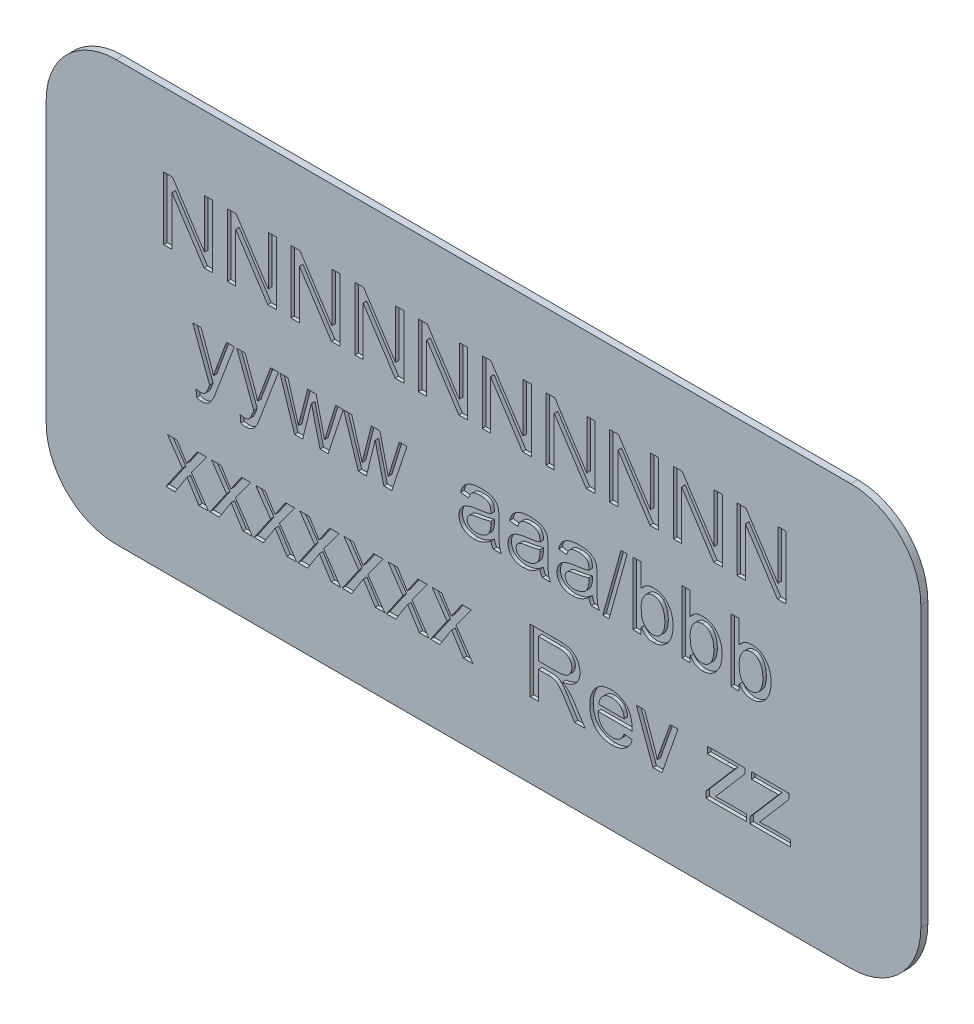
SolidWorks part; units mm, degrees
ref_plane "Plan de face" through (0, 0, 0) normal (0, 0, 1) x (1, 0, 0)
ref_plane "Plan de dessus" through (0, 0, 0) normal (0, 1, 0) x (1, 0, 0)
ref_plane "Plan de droite" through (0, 0, 0) normal (1, 0, 0) x (0, 0, -1)
sketch "Esquisse1" plane through (0, 0, 0) normal (0, 0, 1) x (1, 0, 0)
  line L1 (2, 0) -> (23, 0)
  line L2 (0, 2) -> (0, 10)
  line L3 (2, 12) -> (23, 12)
  line L4 (25, 2) -> (25, 10)
  arc A0 (0, 10) -> (2, 12) centre (2, 10) cw
  arc A1 (2, 0) -> (0, 2) centre (2, 2) cw
  arc A2 (23, 0) -> (25, 2) centre (23, 2) ccw
  arc A3 (23, 12) -> (25, 10) centre (23, 10) cw
  point P7 (0, 12)
  point P10 (0, 0)
  point P15 (25, 12)
  dimension "D3" = 2
  dimension "D1" = 25
  dimension "D2" = 12
extrude "Extrusion1" add sketch "Esquisse1" along normal blind 0.2
sketch "Esquisse2" plane through (0, 0, 0.2) normal (0, 0, 1) x (1, 0, 0)
  text T0 "xxxxxxx  Rev zz" font "@Arial Unicode MS" height in points 7
extrude "Extrusion2" cut sketch "Esquisse2" against normal blind 0.1
sketch "Esquisse3" plane through (0, 0, 0.2) normal (0, 0, 1) x (1, 0, 0)
  text T0 "NNNNNNNNNN" font "@Arial Unicode MS" height in points 7
extrude "Extrusion3" cut sketch "Esquisse3" against normal blind 0.1
sketch "Esquisse4" plane through (0, 0, 0.2) normal (0, 0, 1) x (1, 0, 0)
  text T0 "yyww  aaa/bbb" font "@Arial Unicode MS" height in points 7
extrude "Extrusion4" cut sketch "Esquisse4" against normal blind 0.1
